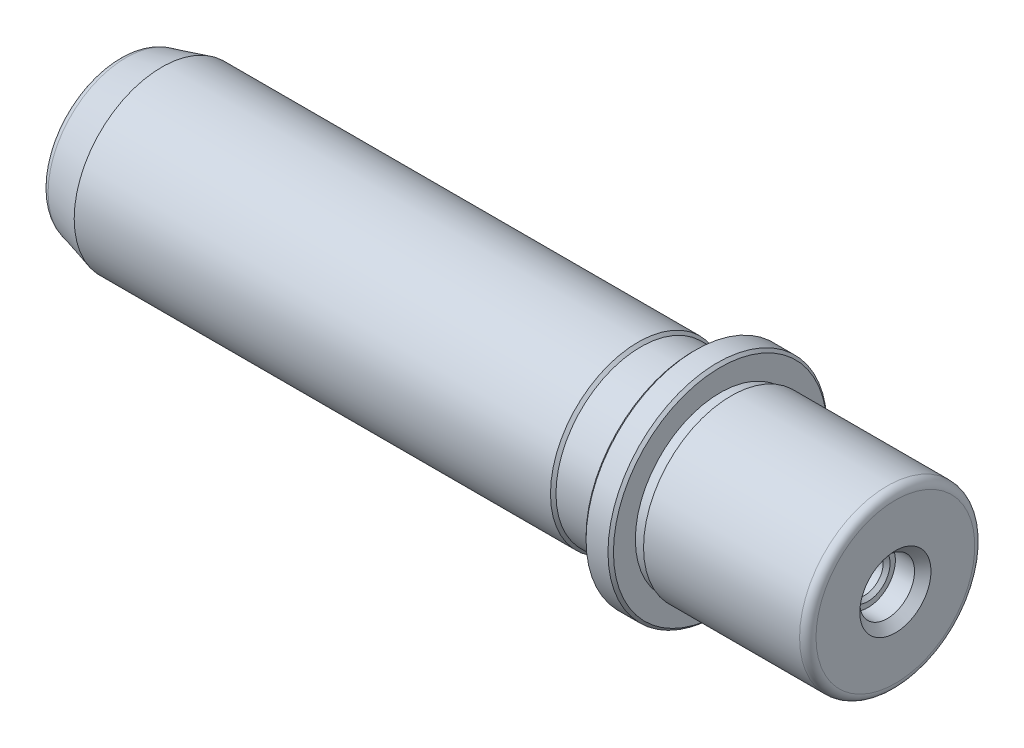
SolidWorks part; units mm, degrees
ref_plane "Plano frontal" through (0, 0, 0) normal (0, 0, 1) x (1, 0, 0)
ref_plane "Plano superior" through (0, 0, 0) normal (0, 1, 0) x (1, 0, 0)
ref_plane "Plano direito" through (0, 0, 0) normal (1, 0, 0) x (0, 0, -1)
sketch "Esboço1" plane through (0, 0, 0) normal (0, 0, 1) x (1, 0, 0)
  line L0 (0, 0) -> (142, 0) construction
  line L1 (0, 6.5) -> (0, 12.3218)
  line L2 (1.4824, 14.2536) -> (8, 16)
  line L3 (8, 16) -> (95, 16)
  line L5 (95.5, 15.5) -> (104.5, 15.5)
  line L7 (105.5, 20) -> (109.5, 20)
  line L8 (110, 19.5) -> (110, 15.5)
  line L10 (142, 14.5) -> (142, 6.5)
  line L12 (140.5, 16) -> (112, 16)
  line L13 (112, 15.5) -> (110, 15.5)
  line L14 (112, 15.5) -> (112, 16)
  line L15 (95, 16) -> (95.5, 15.5)
  line L16 (105, 19.5) -> (105, 16)
  line L17 (104.5, 15.5) -> (105, 16)
  line L18 (5, 0) -> (137, 0)
  line L23 (109.5, 20) -> (110, 19.5)
  line L24 (105.5, 20) -> (105, 19.5)
  line L25 (5, 0) -> (5, 5)
  line L26 (5, 5) -> (1.5, 5)
  line L27 (1.5, 5) -> (0, 6.5)
  line L28 (137, 0) -> (137, 5)
  line L29 (137, 5) -> (140.5, 5)
  line L30 (140.5, 5) -> (142, 6.5)
  arc A0 (0, 12.3218) -> (1.4824, 14.2536) centre (2, 12.3218) cw
  arc A1 (140.5, 16) -> (142, 14.5) centre (140.5, 14.5) cw
  point P10 (105, 20)
  point P11 (110, 20)
  point P24 (0, 13.8564)
  dimension "D13" = 2
  dimension "D18" = 1.5
  dimension "D1" = 142
  dimension "D2" = 32
  dimension "D3" = 8
  dimension "D4" = 15
  dimension "D5" = 10
  dimension "D6" = 31
  dimension "D7" = 40
  dimension "D8" = 45
  dimension "D9" = 45
  dimension "D10" = 5
  dimension "D11" = 110
  dimension "D12" = 2
  dimension "D14" = 5
  dimension "D15" = 5
  dimension "D16" = 1.5
  dimension "D17" = 5
  dimension "D19" = 45
  dimension "D22" = 5
  dimension "D23" = 45
  dimension "D24" = 1.5
revolve "Revolução1" add sketch "Esboço1" angle 360 about L0
hole_wizard "Furo roscado de M8x1.251" positions "3DSketch1" profile "Esboço2" tap size "M8x1.25" standard "Ansi Metric"
sketch3d "3DSketch1"
  line L0 (5, 0, 0) -> (1.5, 0, 0) construction
  circle A1 centre (140.5, 0, 0) radius 16 construction
  circle A2 centre (140.5, 0, 0) radius 5 construction
  point P5 (5, 0, 0)
  point P14 (140.5, 0, 0)
  point P18 (124.5, 0, 0)
  point P19 (140.5, 0, 0)
  point P21 (140.5, 0, 0)
  point P23 (140.5, 0, 0)
  point P25 (140.5, 0, 0)
  point P31 (140.5, 0, 0)
  point P34 (137, 0, 0)
  point P40 (135.5, 0, 0)
sketch "Esboço2" plane through (5, 0, 0) normal (0, 1, 0) x (0, 0, 1)
  line L0 (0, 0) -> (0, 24.2929)
  line L1 (0, 24.2929) -> (3.4, 22.25)
  line L2 (3.4, 22.25) -> (3.4, 0.625)
  line L3 (3.4, 0.625) -> (4.025, 0)
  line L5 (4.025, 0) -> (0, 0)
  line L6 (-3.4, 0.625) -> (-4.025, 0) construction
  line L10 (0, 24.2929) -> (-3.4, 22.25) construction
  line L11 (0, -6.35) -> (0, 107.95) construction
  dimension "Tap Drill Dia." = 6.8
  dimension "Tap Drill Depth" = 22.25
  dimension "Near C'Sink Dia." = 8.05
  dimension "Near C'Sink Angle" = 90
  dimension "Drill Angle" = 118
